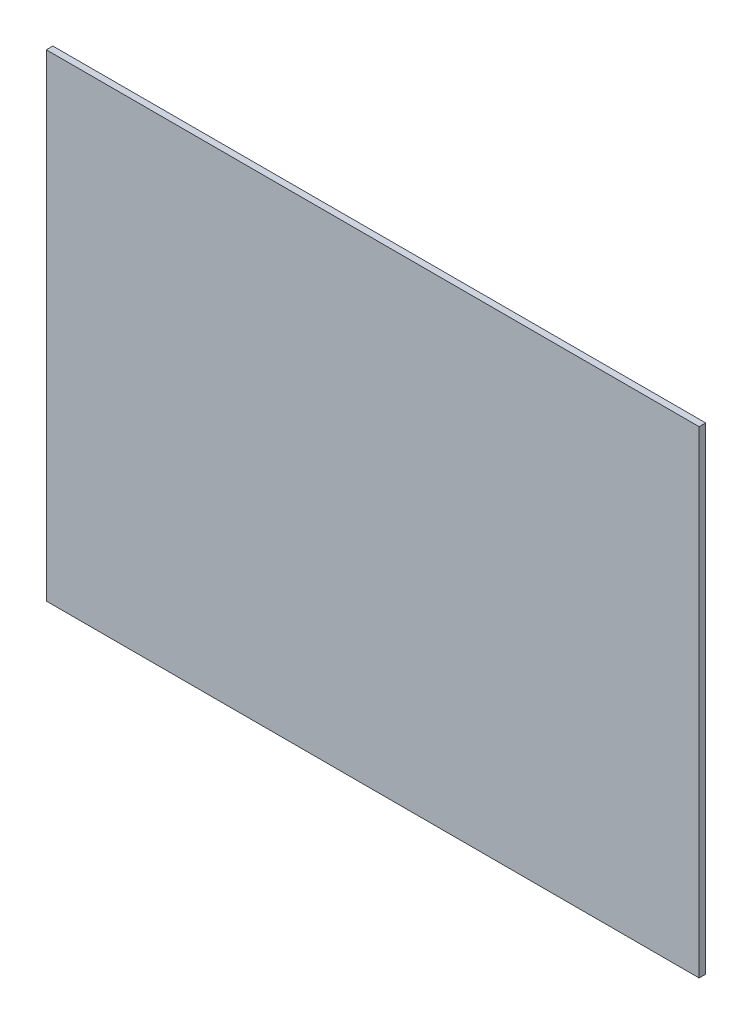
SolidWorks part; units mm, degrees
ref_plane "Alzado" through (0, 0, 0) normal (0, 0, 1) x (1, 0, 0)
ref_plane "Planta" through (0, 0, 0) normal (0, 1, 0) x (1, 0, 0)
ref_plane "Vista lateral" through (0, 0, 0) normal (1, 0, 0) x (0, 0, -1)
sketch "Croquis1" plane through (0, 0, 0) normal (0, 0, 1) x (1, 0, 0)
  line L1 (-423.236, 344.9552) -> (574.964, 344.9552)
  line L2 (-423.236, 344.9552) -> (-423.236, -385.0448)
  line L3 (-423.236, -385.0448) -> (574.964, -385.0448)
  line L4 (574.964, 344.9552) -> (574.964, -385.0448)
  dimension "D1" = 998.2
  dimension "D2" = 730
extrude "Saliente-Extruir1" add sketch "Croquis1" along normal blind 10
